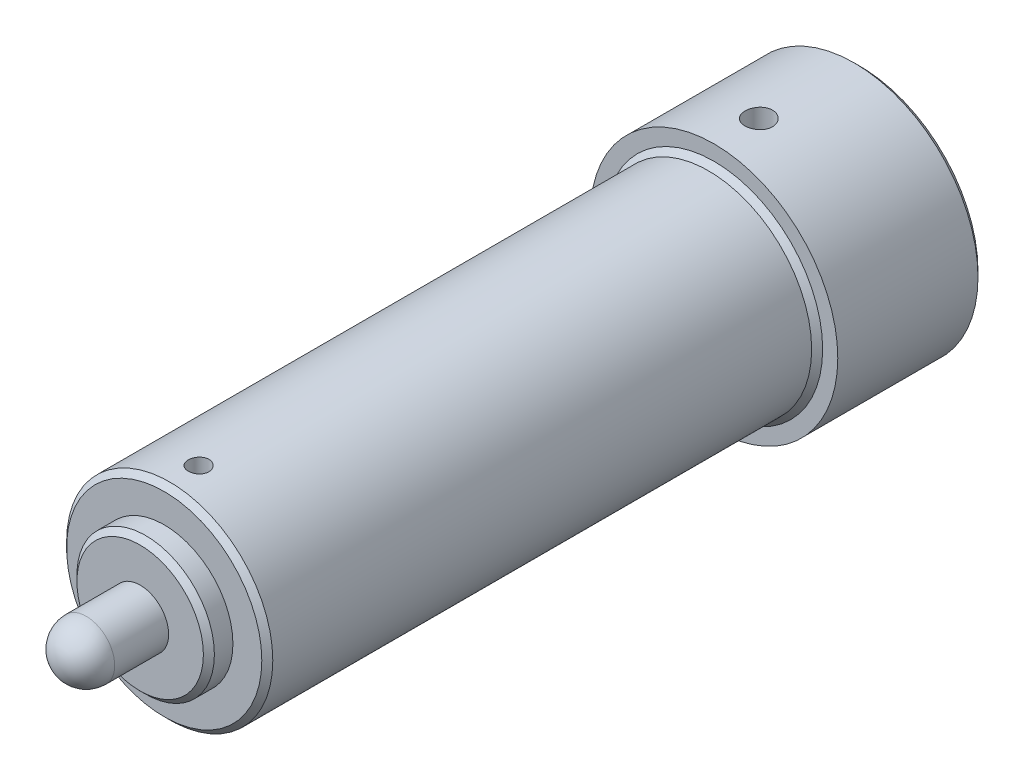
SolidWorks part; units mm, degrees
ref_plane "Front Plane" through (0, 0, 0) normal (0, 0, 1) x (1, 0, 0)
ref_plane "Top Plane" through (0, 0, 0) normal (0, 1, 0) x (1, 0, 0)
ref_plane "Right Plane" through (0, 0, 0) normal (1, 0, 0) x (0, 0, -1)
sketch "Sketch1" plane through (0, 0, 0) normal (0, 0, 1) x (1, 0, 0)
  circle A0 centre (0, 0) radius 18
  dimension "D1" = 36
extrude "Boss-Extrude1" add sketch "Sketch1" along normal blind 21.2
sketch "Sketch2" plane through (0, 0, 21.2) normal (0, 0, 1) x (1, 0, 0)
  circle A0 centre (0, 0) radius 15
  dimension "D1" = 30
extrude "Boss-Extrude2" add sketch "Sketch2" along normal blind 80
sketch "Sketch3" plane through (0, 0, 101.2) normal (0, 0, 1) x (1, 0, 0)
  circle A0 centre (0, 0) radius 10
  dimension "D1" = 20
extrude "Boss-Extrude3" add sketch "Sketch3" along normal blind 3.5
sketch "Sketch4" plane through (0, 0, 104.7) normal (0, 0, 1) x (1, 0, 0)
  circle A0 centre (0, 0) radius 4.15
  dimension "D1" = 8.3
extrude "Boss-Extrude4" add sketch "Sketch4" along normal blind 12
fillet "Fillet1" radius 4.15 1 edges at (4.15, 0, 116.7)
chamfer "Chamfer1" distance 0.8 angle 45 4 edges at (18, 0, 0) (15, 0, 21.2) (15, 0, 101.2) (10, 0, 104.7)
sketch "Sketch5" plane through (0, 0, 0) normal (0, 1, 0) x (1, 0, 0)
  line L0 (0, 0) -> (0, -116.7) construction
  line L1 (17.2, 0) -> (-17.2, 0) construction
  line L2 (-14.2, -101.2) -> (14.2, -101.2) construction
  arc A0 (-4.15, -112.55) -> (4.15, -112.55) centre (0, -112.55) ccw construction
  circle A1 centre (0, -14.7) radius 2
  circle A2 centre (0, -96.2) radius 1.5
  dimension "D1" = 4
  dimension "D2" = 3
  dimension "D4" = 5
  dimension "D3" = 81.5
extrude "Cut-Extrude1" cut sketch "Sketch5" against normal through all both and the other way through all
sketch "Sketch6" plane through (0, 0, 0) normal (0, 0, -1) x (-1, 0, 0)
  circle A0 centre (0, 0) radius 15.5
  dimension "D1" = 31
extrude "Cut-Extrude2" cut sketch "Sketch6" against normal blind 4 and the other way through all
